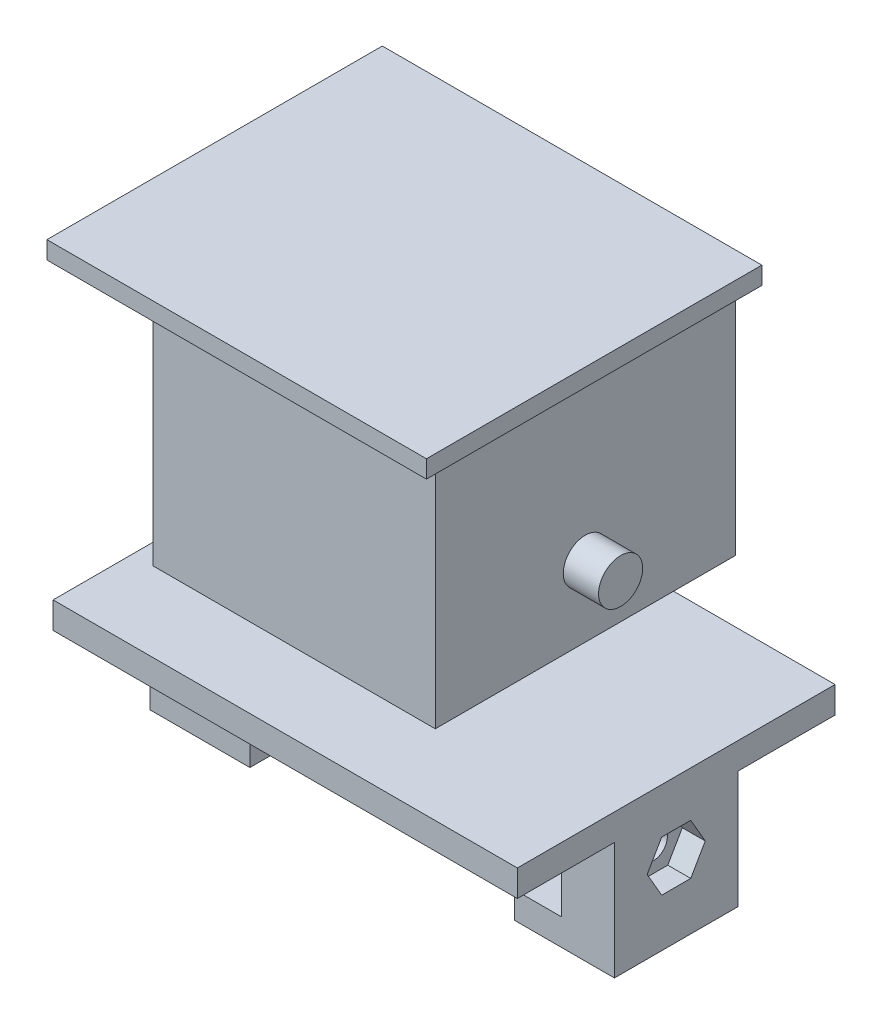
SolidWorks part; units mm, degrees
ref_plane "前视基准面" through (0, 0, 0) normal (0, 0, 1) x (1, 0, 0)
ref_plane "上视基准面" through (0, 0, 0) normal (0, 1, 0) x (1, 0, 0)
ref_plane "右视基准面" through (0, 0, 0) normal (1, 0, 0) x (0, 0, -1)
other "Configuration Table"
sketch "Sketch_Mount_Cap_52p6x36x3" plane through (0, 0, 0) normal (0, 0, 1) x (1, 0, 0)
  line L1 (-26.3, 0) -> (26.3, 0)
  line L2 (-26.3, 0) -> (-26.3, 3)
  line L3 (-26.3, 3) -> (26.3, 3)
  line L4 (26.3, 0) -> (26.3, 3)
  dimension "D1" = 26.3
  dimension "D2" = 26.3
  dimension "D3" = 3
extrude "Mount_Cap_52p6x36x3" add sketch "Sketch_Mount_Cap_52p6x36x3" along normal mid plane 36
sketch "Sketch_Clamp_Right_Cheek" plane through (0, 0, 0) normal (0, 0, 1) x (1, 0, 0)
  line L1 (20.3, -13.3) -> (26.3, -13.3)
  line L2 (20.3, -13.3) -> (20.3, 3)
  line L3 (20.3, 3) -> (26.3, 3)
  line L4 (26.3, -13.3) -> (26.3, 3)
  dimension "D1" = 20.3
  dimension "D2" = 13.3
extrude "Clamp_Right_Cheek" add sketch "Sketch_Clamp_Right_Cheek" along normal mid plane 14
sketch "Sketch_Clamp_Left_Cheek" plane through (0, 0, 0) normal (0, 0, 1) x (1, 0, 0)
  line L0 (26.3, 3) -> (-26.3, 3) construction
  line L1 (-26.3, -13.3) -> (-20.3, -13.3)
  line L2 (-26.3, -13.3) -> (-26.3, 3)
  line L3 (-26.3, 3) -> (-20.3, 3)
  line L4 (-20.3, -13.3) -> (-20.3, 3)
  dimension "D1" = 20.3
  dimension "D2" = 26.3
  dimension "D3" = 13.3
extrude "Clamp_Left_Cheek" add sketch "Sketch_Clamp_Left_Cheek" along normal mid plane 14
sketch "Sketch_Clamp_Right_Underlip" plane through (0, 0, 0) normal (0, 0, 1) x (1, 0, 0)
  line L0 (26.3, -13.3) -> (26.3, 0) construction
  line L1 (15, -13.3) -> (26.3, -13.3)
  line L2 (15, -13.3) -> (15, -10.3)
  line L3 (15, -10.3) -> (26.3, -10.3)
  line L4 (26.3, -13.3) -> (26.3, -10.3)
  dimension "D1" = 15
  dimension "D2" = 10.3
  dimension "D3" = 13.3
extrude "Clamp_Right_Underlip" add sketch "Sketch_Clamp_Right_Underlip" along normal mid plane 14
sketch "Sketch_Clamp_Left_Underlip" plane through (0, 0, 0) normal (0, 0, 1) x (1, 0, 0)
  line L1 (-26.3, -13.3) -> (-15, -13.3)
  line L2 (-26.3, -13.3) -> (-26.3, -10.3)
  line L3 (-26.3, -10.3) -> (-15, -10.3)
  line L4 (-15, -13.3) -> (-15, -10.3)
  dimension "D1" = 15
  dimension "D2" = 10.3
extrude "Clamp_Left_Underlip" add sketch "Sketch_Clamp_Left_Underlip" along normal mid plane 14
sketch "Sketch_Camera_Pedestal_14x14x8" plane through (0, 0, 0) normal (0, 0, 1) x (1, 0, 0)
  line L0 (26.3, 3) -> (-26.3, 3) construction
  line L1 (-7, 3) -> (7, 3)
  line L2 (-7, 3) -> (-7, 11)
  line L3 (-7, 11) -> (7, 11)
  line L4 (7, 3) -> (7, 11)
  dimension "D1" = 7
  dimension "D2" = 7
  dimension "D3" = 11
extrude "Camera_Pedestal_14x14x8" add sketch "Sketch_Camera_Pedestal_14x14x8" along normal mid plane 14
sketch "Sketch_Camera_Enclosure_32x34x26" plane through (0, 0, 0) normal (0, 0, 1) x (1, 0, 0)
  line L1 (-16, 11) -> (16, 11)
  line L2 (-16, 11) -> (-16, 37)
  line L3 (-16, 37) -> (16, 37)
  line L4 (16, 11) -> (16, 37)
  dimension "D1" = 16
  dimension "D2" = 16
  dimension "D3" = 11
  dimension "D4" = 37
extrude "Camera_Enclosure_32x34x26" add sketch "Sketch_Camera_Enclosure_32x34x26" along normal mid plane 34
sketch "Sketch_Sun_Visor_43x38x2" plane through (0, 0, 0) normal (0, 0, 1) x (1, 0, 0)
  line L1 (-26, 37) -> (17, 37)
  line L2 (-26, 37) -> (-26, 39)
  line L3 (-26, 39) -> (17, 39)
  line L4 (17, 37) -> (17, 39)
  dimension "D1" = 17
  dimension "D2" = 26
  dimension "D3" = 37
  dimension "D4" = 39
extrude "Sun_Visor_43x38x2" add sketch "Sketch_Sun_Visor_43x38x2" along normal mid plane 38
sketch "Sketch_Lens_Barrel_D20" plane through (0, 0, 0) normal (1, 0, 0) x (0, 0, -1)
  circle A0 centre (0, 24) radius 10
  dimension "D1" = 20
  dimension "D2" = 24
extrude "Lens_Barrel_D20" add sketch "Sketch_Lens_Barrel_D20" against normal blind 5 from offset 16
sketch "Sketch_Lens_Focus_Ring_D16" plane through (0, 0, 0) normal (1, 0, 0) x (0, 0, -1)
  circle A0 centre (0, 24) radius 8
  dimension "D1" = 16
  dimension "D2" = 24
extrude "Lens_Focus_Ring_D16" add sketch "Sketch_Lens_Focus_Ring_D16" against normal blind 3 from offset 21
sketch "Sketch_Lens_Glass_D13p6" plane through (0, 0, 0) normal (1, 0, 0) x (0, 0, -1)
  circle A0 centre (0, 24) radius 6.8
  dimension "D1" = 13.6
  dimension "D2" = 24
extrude "Lens_Glass_D13p6" add sketch "Sketch_Lens_Glass_D13p6" against normal blind 0.7 from offset 24
sketch "Sketch_IR_Window_Left_D4" plane through (0, 0, 0) normal (1, 0, 0) x (0, 0, -1)
  circle A0 centre (11, 31) radius 2
  dimension "D1" = 4
  dimension "D2" = 11
  dimension "D3" = 31
extrude "IR_Window_Left_D4" add sketch "Sketch_IR_Window_Left_D4" against normal blind 0.6 from offset 16
sketch "Sketch_IR_Window_Right_D4" plane through (0, 0, 0) normal (1, 0, 0) x (0, 0, -1)
  circle A0 centre (-11, 31) radius 2
  dimension "D1" = 4
  dimension "D2" = 11
  dimension "D3" = 31
extrude "IR_Window_Right_D4" add sketch "Sketch_IR_Window_Right_D4" against normal blind 0.6 from offset 16
sketch "Sketch_Rear_Cable_Gland_D5" plane through (0, 0, 0) normal (1, 0, 0) x (0, 0, -1)
  circle A0 centre (0, 19) radius 2.5
  dimension "D1" = 5
  dimension "D2" = 19
extrude "Rear_Cable_Gland_D5" add sketch "Sketch_Rear_Cable_Gland_D5" along normal blind 4 from offset 16
sketch "Sketch_Clamp_2xD3p2_M3_Clearance" plane through (0, 0, 0) normal (1, 0, 0) x (0, 0, -1)
  circle A0 centre (0, -5) radius 1.6
  dimension "D1" = 3.2
  dimension "D2" = 5
extrude "Clamp_2xD3p2_AtYminus5Z0" cut sketch "Sketch_Clamp_2xD3p2_M3_Clearance" against normal mid plane 60
sketch "Sketch_M3_NutPocket_False" plane through (0, 0, 0) normal (1, 0, 0) x (0, 0, -1)
  line L0 (-3.2909, -5) -> (-1.6454, -2.15)
  line L1 (-1.6454, -2.15) -> (1.6454, -2.15)
  line L2 (1.6454, -2.15) -> (3.2909, -5)
  line L3 (3.2909, -5) -> (1.6454, -7.85)
  line L4 (1.6454, -7.85) -> (-1.6454, -7.85)
  line L5 (-1.6454, -7.85) -> (-3.2909, -5)
  dimension "D1" = 1.6454
  dimension "D2" = 3.2909
  dimension "D3" = 1.6454
  dimension "D4" = 2.15
extrude "M3_Nut_AF5p7_Depth2p6_False" cut sketch "Sketch_M3_NutPocket_False" against normal blind 2.6 from offset 26.3
sketch "Sketch_M3_NutPocket_True" plane through (0, 0, 0) normal (1, 0, 0) x (0, 0, -1)
  line L0 (-3.2909, -5) -> (-1.6454, -2.15)
  line L1 (-1.6454, -2.15) -> (1.6454, -2.15)
  line L2 (1.6454, -2.15) -> (3.2909, -5)
  line L3 (3.2909, -5) -> (1.6454, -7.85)
  line L4 (1.6454, -7.85) -> (-1.6454, -7.85)
  line L5 (-1.6454, -7.85) -> (-3.2909, -5)
extrude "M3_Nut_AF5p7_Depth2p6_True" cut sketch "Sketch_M3_NutPocket_True" along normal blind 2.6 from offset 26.3
